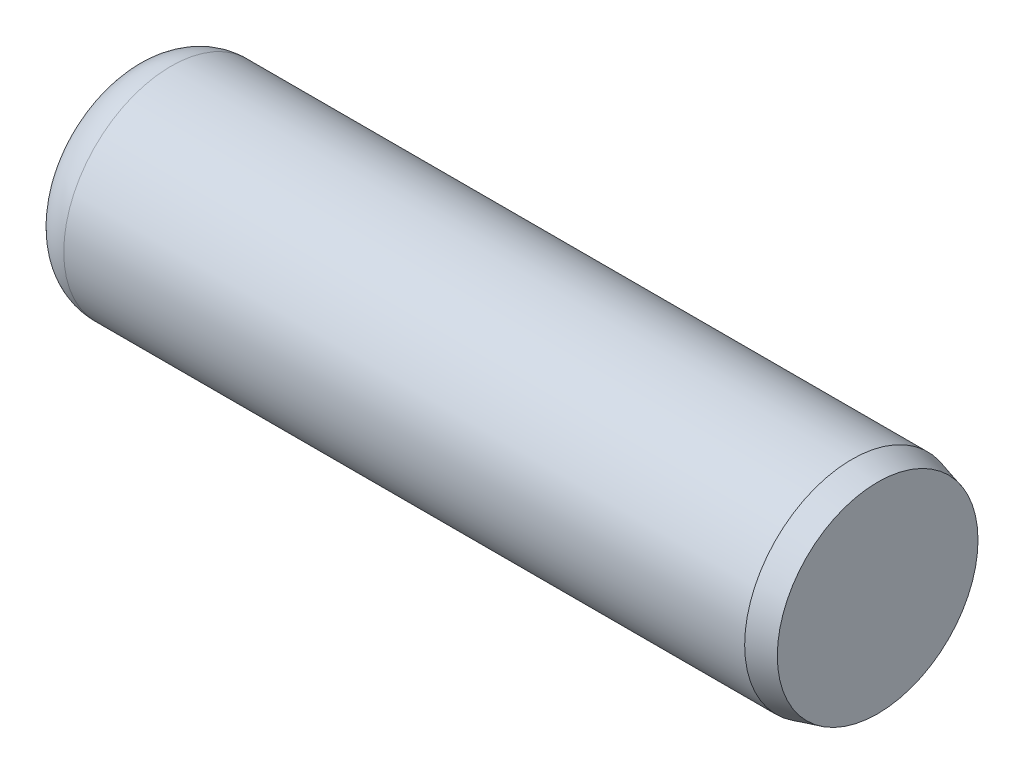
SolidWorks part; units mm, degrees
ref_plane "Plane1" through (0, 0, 0) normal (0, 0, 1) x (1, 0, 0)
ref_plane "Plane2" through (0, 0, 0) normal (0, 1, 0) x (1, 0, 0)
ref_plane "Plane3" through (0, 0, 0) normal (1, 0, 0) x (0, 0, -1)
sketch "Sketch1" plane through (0, 0, 0) normal (0, 0, 1) x (1, 0, 0)
  line L1 (-6.35, 0) -> (107.95, 0) construction
  line L2 (0, 0) -> (11.1125, 0)
  line L3 (11.1125, 0) -> (11.1125, 1.4878)
  line L4 (11.1125, 1.4878) -> (10.7309, 1.59)
  line L5 (10.7309, 1.59) -> (0.636, 1.59)
  line L6 (0, 0.954) -> (0, 0)
  arc A0 (0.636, 1.59) -> (0, 0.954) centre (0.636, 0.954) ccw
  dimension "D4" = 0.636
  dimension "D2" = 0.3816
  dimension "D3" = 15
  dimension "Diameter" = 3.1801
  dimension "Length" = 11.1125
revolve "Base-Revolve" add sketch "Sketch1" angle 360 about L1
equation "\"D4@Sketch1\" = \"Diameter@Sketch1\" * 0.2"
equation "\"D2@Sketch1\" = \"Diameter@Sketch1\" * 0.12"
equation "\"D3@Sketch1\" = 15.0"
